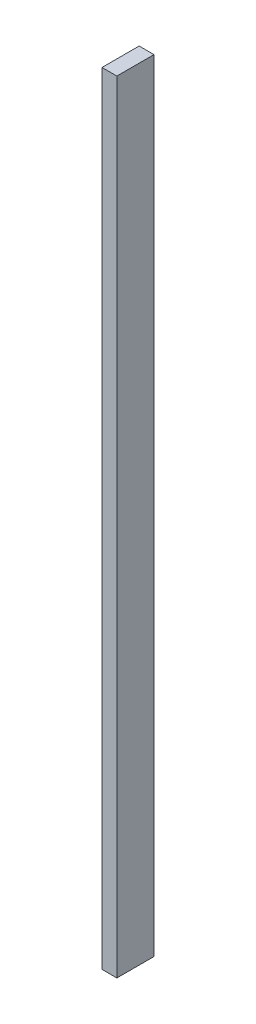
SolidWorks part; units mm, degrees
ref_plane "Plan de face" through (0, 0, 0) normal (0, 0, 1) x (1, 0, 0)
ref_plane "Plan de dessus" through (0, 0, 0) normal (0, 1, 0) x (1, 0, 0)
ref_plane "Plan de droite" through (0, 0, 0) normal (1, 0, 0) x (0, 0, -1)
sketch "Esquisse1" plane through (0, 0, 0) normal (0, 1, 0) x (1, 0, 0)
  line L1 (0, 0) -> (20, 0)
  line L2 (0, 0) -> (0, 50)
  line L3 (0, 50) -> (20, 50)
  line L4 (20, 0) -> (20, 50)
  dimension "D1" = 20
  dimension "D2" = 50
extrude "Extrusion1" add sketch "Esquisse1" along normal blind 1051
